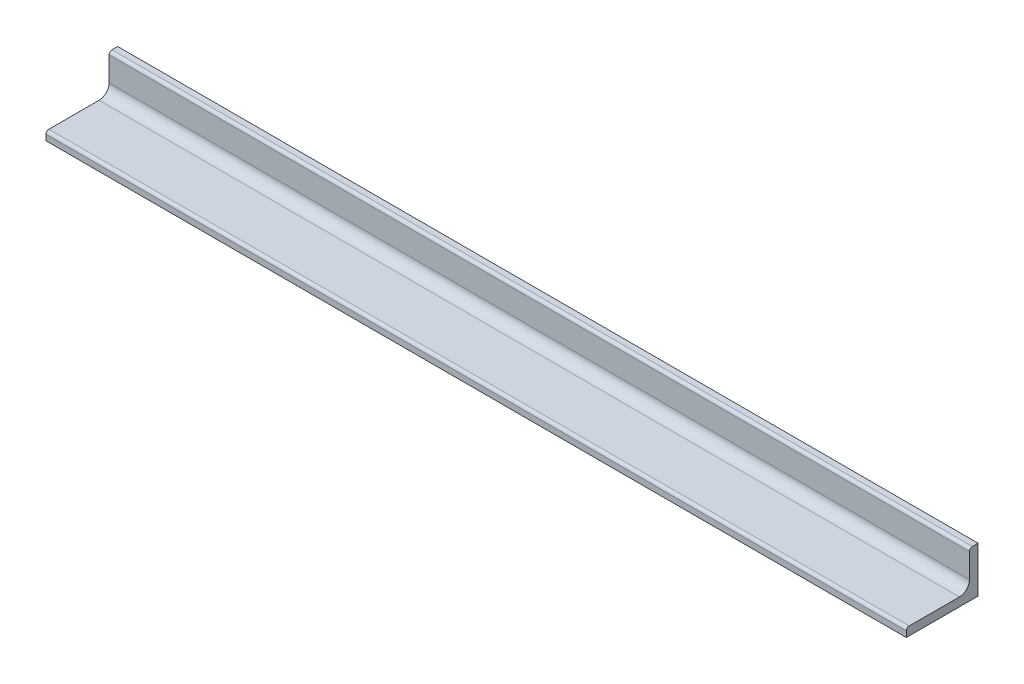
SolidWorks part; units mm, degrees
ref_plane "Front" through (0, 0, 0) normal (0, 0, 1) x (1, 0, 0)
ref_plane "Top" through (0, 0, 0) normal (0, 1, 0) x (1, 0, 0)
ref_plane "Right" through (0, 0, 0) normal (1, 0, 0) x (0, 0, -1)
sketch "Sketch1" plane through (0, 0, 0) normal (1, 0, 0) x (0, 1, 0)
  line L0 (0, 25) -> (0, 0)
  line L1 (0, 0) -> (16, 0)
  line L2 (3, 24) -> (3, 6.5)
  line L3 (6.5, 3) -> (15, 3)
  line L4 (0, 25) -> (2, 25)
  line L5 (16, 0) -> (16, 2)
  arc A0 (2, 25) -> (3, 24) centre (2, 24) cw
  arc A1 (16, 2) -> (15, 3) centre (15, 2) ccw
  arc A2 (3, 6.5) -> (6.5, 3) centre (6.5, 6.5) ccw
  dimension "r1" = 1
  dimension "r" = 3.5
  dimension "a" = 25
  dimension "d1" = 3
  dimension "d" = 3
  dimension "b" = 16
extrude "Base" add sketch "Sketch1" along normal blind 300
equation "\"r1@Sketch1\" = \"d@Sketch1\" / 3"
equation "\"d1@Sketch1\" = \"d@Sketch1\""
